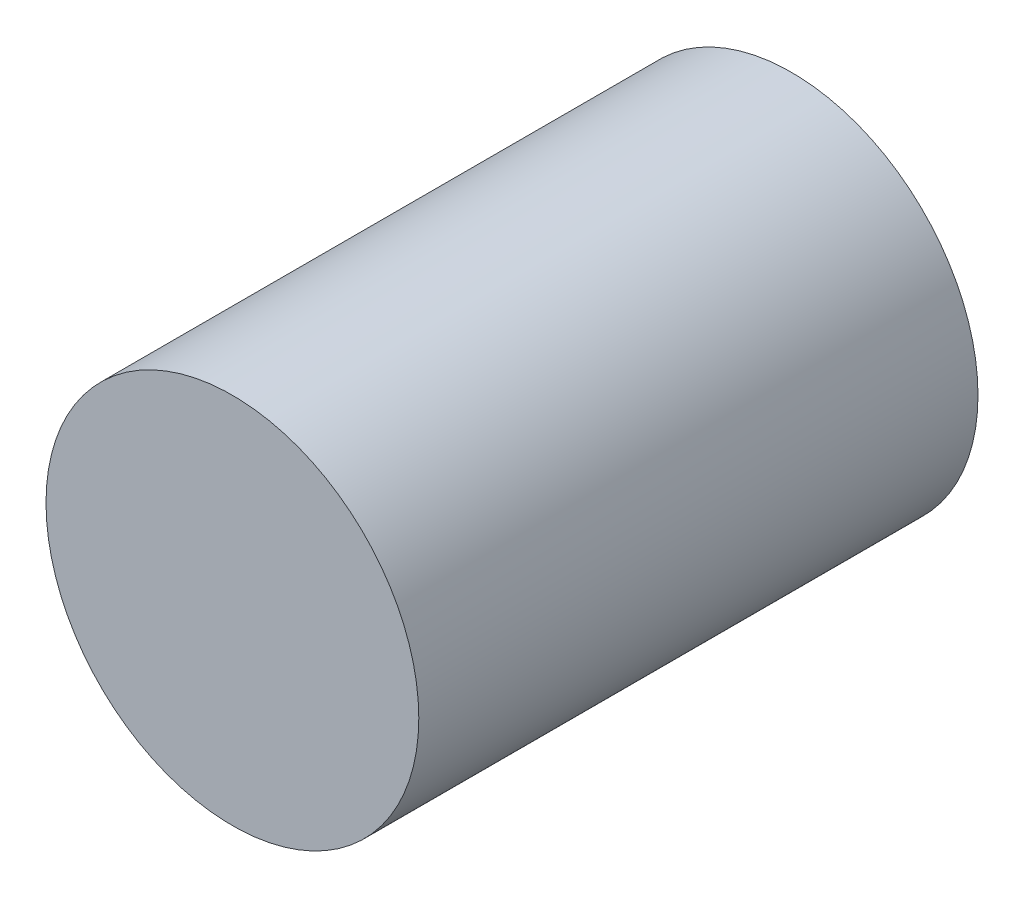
SolidWorks part; units mm, degrees
ref_plane "Front Plane" through (0, 0, 0) normal (0, 0, 1) x (1, 0, 0)
ref_plane "Top Plane" through (0, 0, 0) normal (0, 1, 0) x (1, 0, 0)
ref_plane "Right Plane" through (0, 0, 0) normal (1, 0, 0) x (0, 0, -1)
sketch "Sketch1" plane through (0, 0, 0) normal (0, 0, 1) x (1, 0, 0)
  circle A0 centre (0, 0) radius 50.8
  dimension "D1" = 101.6
extrude "Extrude1" add sketch "Sketch1" along normal mid plane 152.4
